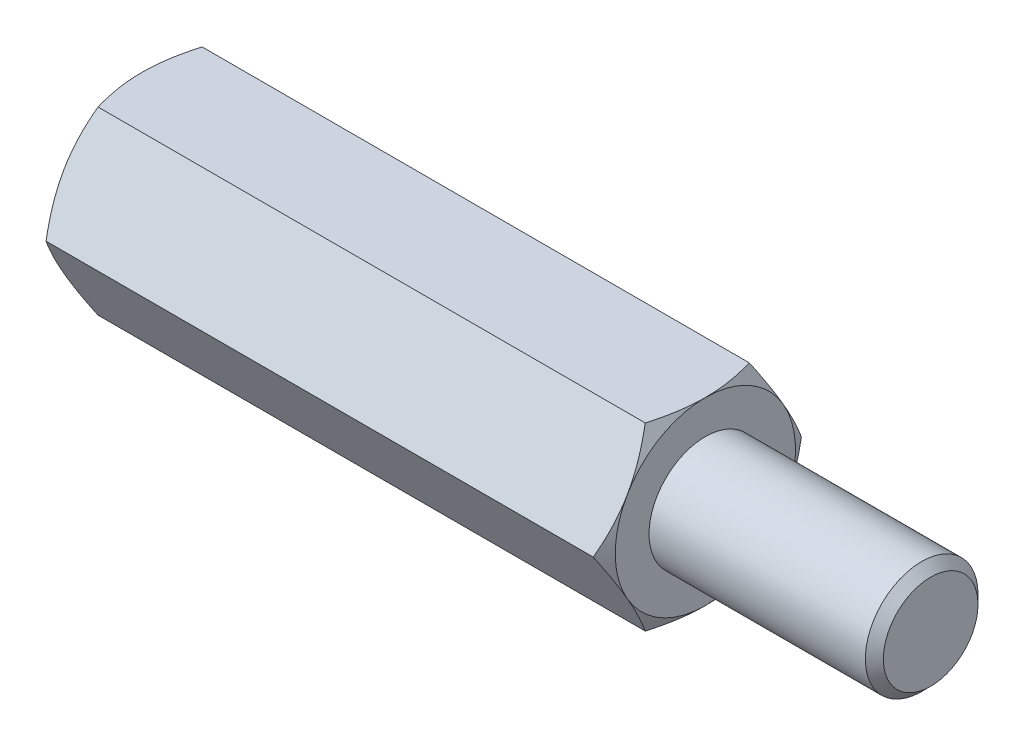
SolidWorks part; units mm, degrees
ref_plane "Front Plane" through (0, 0, 0) normal (0, 0, 1) x (1, 0, 0)
ref_plane "Top Plane" through (0, 0, 0) normal (0, 1, 0) x (1, 0, 0)
ref_plane "Right Plane" through (0, 0, 0) normal (1, 0, 0) x (0, 0, -1)
sketch "Sketch1" plane through (0, 0, 0) normal (1, 0, 0) x (0, 0, -1)
  line L1 (2.3094, 4) -> (-2.3094, 4)
  line L2 (-2.3094, 4) -> (-4.6188, 0)
  line L3 (-4.6188, 0) -> (-2.3094, -4)
  line L4 (-2.3094, -4) -> (2.3094, -4)
  line L5 (2.3094, -4) -> (4.6188, 0)
  line L6 (4.6188, 0) -> (2.3094, 4)
  circle A0 centre (0, 0) radius 4 construction
  dimension "D1" = 8
extrude "Extrude2" add sketch "Sketch1" along normal mid plane 25
sketch "Sketch2" plane through (0, 0, 0) normal (0, 0, 1) x (1, 0, 0)
  line L0 (-12.5, 4) -> (-11, 6.5981)
  line L1 (-12.5, 7) -> (-12.5, 4)
  line L3 (0, 0) -> (50000, 0) construction
  arc A0 (-11, 6.5981) -> (-12.5, 7) centre (-11.6962, 7) ccw
  dimension "D1" = 30
  dimension "D2" = 3
revolve "Cut-Revolve1" cut sketch "Sketch2" angle 360 about L3
mirror "Mirror1" about plane through (0, 0, 0) normal (1, 0, 0) of "Cut-Revolve1"
sketch "Sketch3" plane through (-12.5, 0, 0) normal (-1, 0, 0) x (0, 0, 1)
  circle A0 centre (0, 0) radius 2.1
  dimension "D1" = 4.2
extrude "Extrude3" cut sketch "Sketch3" against normal blind 10
sketch "Sketch4" plane through (0, 0, 0) normal (0, 0, 1) x (1, 0, 0)
  line L0 (-2.5, 0) -> (-2.5, 2.1)
  line L1 (12.1427, 0) -> (-12.1427, 0) construction
  line L2 (-2.5, 2.1) -> (-1.2876, 0)
  line L3 (-1.2876, 0) -> (-2.5, 0)
  line L4 (-12.5, 2) -> (-12.5, -2) construction
  point P4 (-12.5, 0)
  dimension "D1" = 30
  dimension "D2" = 2.1
  dimension "D3" = 10
revolve "Cut-Revolve2" cut sketch "Sketch4" angle 360 about L3
sketch "Sketch5" plane through (12.5, 0, 0) normal (1, 0, 0) x (0, 0, -1)
  circle A0 centre (0, 0) radius 2.5
  dimension "D1" = 5
extrude "Extrude4" add sketch "Sketch5" along normal blind 10
chamfer "Chamfer1" distance 0.4 angle 45 1 edges at (22.5, 0, -2.5)
equation "\"D2@Sketch4\" = \"D1@Sketch3\"/2"
